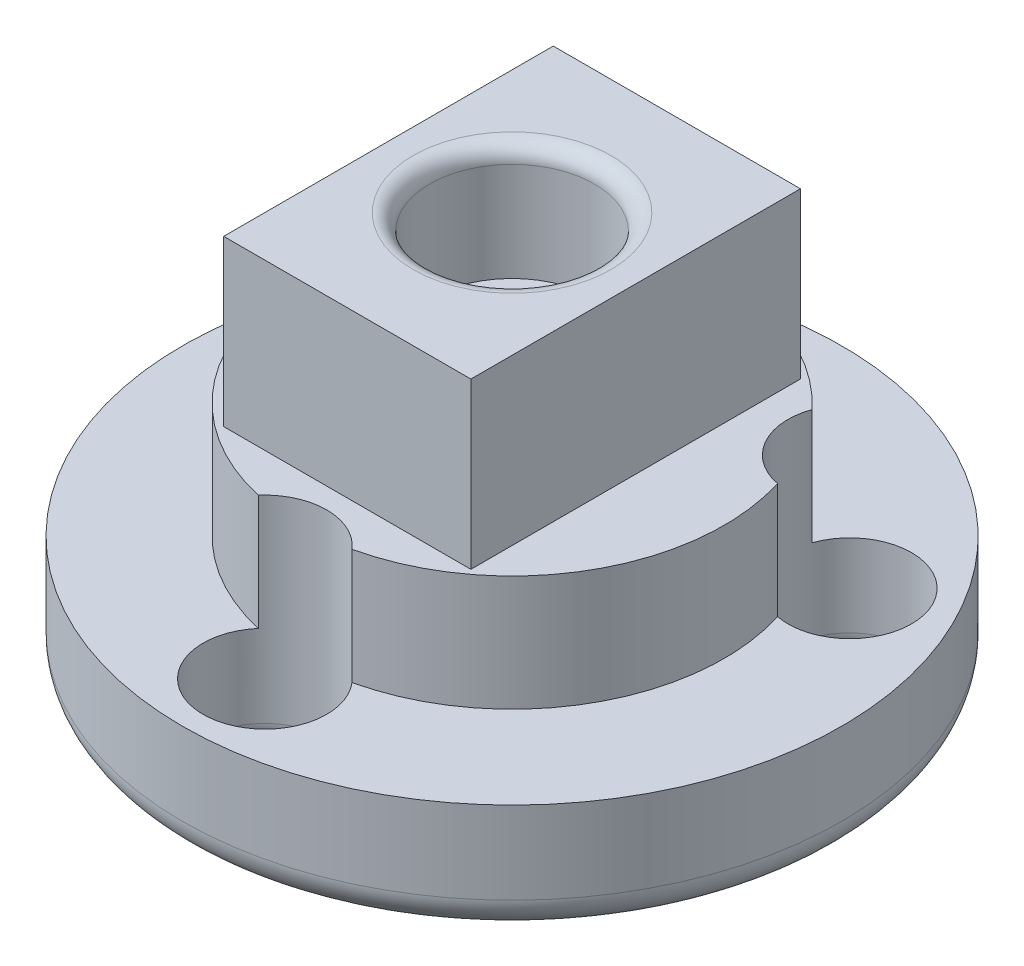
SolidWorks part; units mm, degrees
ref_plane "Ebene vorne" through (0, 0, 0) normal (0, 0, 1) x (1, 0, 0)
ref_plane "Ebene oben" through (0, 0, 0) normal (0, 1, 0) x (1, 0, 0)
ref_plane "Ebene rechts" through (0, 0, 0) normal (1, 0, 0) x (0, 0, -1)
sketch "Skizze1" plane through (0, 0, 0) normal (0, 1, 0) x (1, 0, 0)
  circle A0 centre (0, 0) radius 20
  dimension "D1" = 40
extrude "Aufsatz-Linear austragen1" add sketch "Skizze1" along normal blind 7
sketch "Skizze3" plane through (0, 7, 0) normal (0, 1, 0) x (1, 0, 0)
  circle A0 centre (0, 0) radius 12.875
  dimension "D1" = 25.75
extrude "Aufsatz-Linear austragen2" add sketch "Skizze3" along normal blind 7
sketch "Skizze4" plane through (0, 0, 0) normal (0, -1, 0) x (1, 0, 0)
  circle A0 centre (0, 0) radius 15
  dimension "D1" = 30
sketch "Skizze5" plane through (0, 0, 0) normal (0, -1, 0) x (-1, 0, 0)
  circle A0 centre (0, -15) radius 3.75
  circle A1 centre (0, 0) radius 15 construction
  circle A2 centre (-12.9904, 7.5) radius 3.75
  circle A3 centre (12.9904, 7.5) radius 3.75
  point P11 (0, 0)
  dimension "D1" = 7.5
  dimension "D2" = 3
extrude "Schnitt-Linear austragen1" cut sketch "Skizze5" against normal through all contours A0 | A2 | A3
sketch "Skizze7" plane through (0, 14, 0) normal (0, 1, 0) x (1, 0, 0)
  line L1 (-7.5, 10) -> (7.5, 10)
  line L2 (-7.5, 10) -> (-7.5, -10)
  line L3 (-7.5, -10) -> (7.5, -10)
  line L4 (7.5, 10) -> (7.5, -10)
  dimension "D1" = 15
  dimension "D2" = 7.5
  dimension "D3" = 20
  dimension "D4" = 10
extrude "Aufsatz-Linear austragen3" add sketch "Skizze7" along normal blind 10
sketch "Skizze8" plane through (0, 24, 0) normal (0, 1, 0) x (1, 0, 0)
  circle A0 centre (0, 0) radius 5
extrude "Schnitt-Linear austragen2" cut sketch "Skizze8" against normal blind 7 contours A0
fillet "Verrundung2" radius 1 1 edges at (0, 24, 5)
fillet "Verrundung3" radius 2 4 edges at (0, 0, 11.25) (-12.9904, 0, -11.25) (12.9904, 0, -11.25) (0, 0, 20)
sketch "Skizze9" plane through (0, 0, 0) normal (0, -1, 0) x (1, 0, 0)
  circle A0 centre (0, 0) radius 5
  dimension "D1" = 10
extrude "Schnitt-Linear austragen3" cut sketch "Skizze9" against normal blind 3
